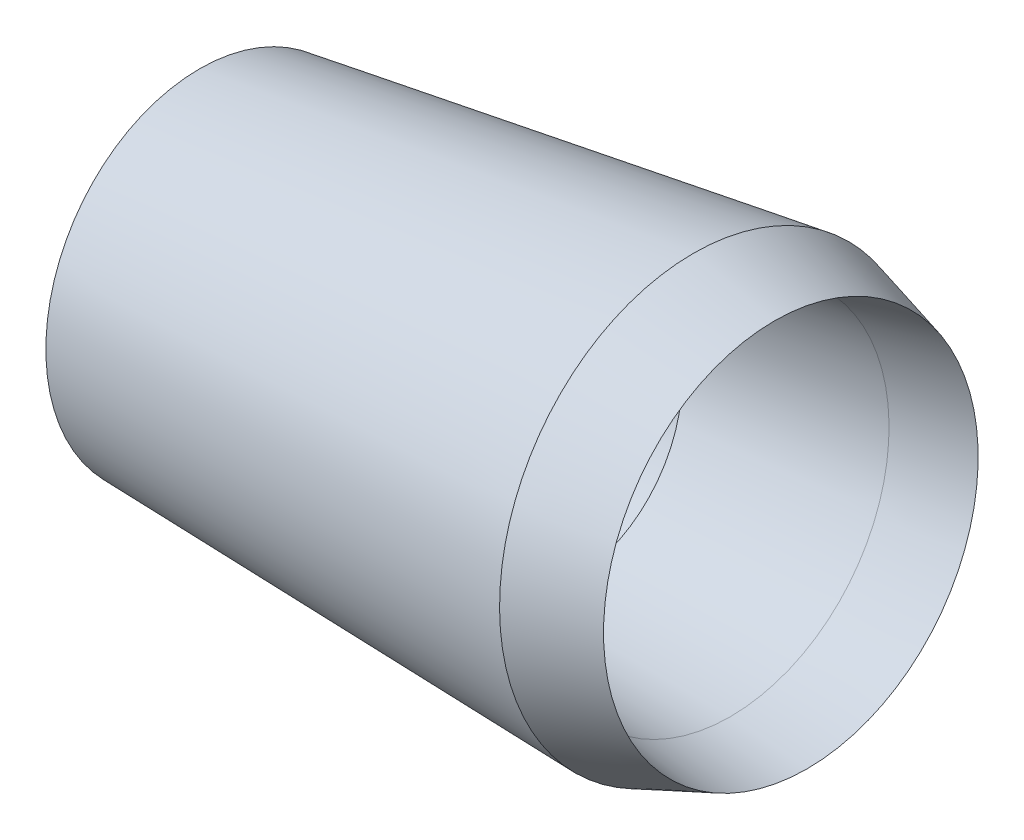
SolidWorks part; units mm, degrees
ref_plane "Front Plane" through (0, 0, 0) normal (0, 0, 1) x (1, 0, 0)
ref_plane "Top Plane" through (0, 0, 0) normal (0, 1, 0) x (1, 0, 0)
ref_plane "Right Plane" through (0, 0, 0) normal (1, 0, 0) x (0, 0, -1)
sketch "Sketch1" plane through (0, 0, 0) normal (0, 0, 1) x (1, 0, 0)
  line L0 (0, 0) -> (97.5367, 0) construction
  line L1 (0, 0) -> (6.35, -6.35)
  line L2 (6.35, -6.35) -> (50.8, -6.35)
  line L4 (292.1, 0) -> (259.4617, 0)
  line L5 (0, 0) -> (0, 25.5554) construction
  line L6 (203.2, -6.35) -> (292.1, -6.35)
  line L7 (145.1617, 12.7) -> (145.1617, 0) construction
  line L8 (0, 6.35) -> (292.1, 6.35) construction
  line L9 (145.1617, 0) -> (151.5117, 6.35)
  line L11 (151.5117, 6.35) -> (154.6867, 6.35)
  line L12 (148.3367, 0) -> (154.6867, 6.35)
  line L13 (-11.1934, -0.9793) -> (308.0638, 26.9521) construction
  line L14 (129.2867, 0) -> (135.6367, 6.35)
  line L16 (132.4617, 0) -> (138.8117, 6.35)
  line L17 (135.6367, 6.35) -> (138.8117, 6.35)
  line L18 (113.4117, 0) -> (119.7617, 6.35)
  line L20 (116.5867, 0) -> (122.9367, 6.35)
  line L21 (119.7617, 6.35) -> (122.9367, 6.35)
  line L22 (97.5367, 0) -> (103.8867, 6.35)
  line L24 (100.7117, 0) -> (107.0617, 6.35)
  line L25 (103.8867, 6.35) -> (107.0617, 6.35)
  line L26 (161.0367, 0) -> (167.3867, 6.35)
  line L28 (164.2117, 0) -> (170.5617, 6.35)
  line L29 (167.3867, 6.35) -> (170.5617, 6.35)
  line L30 (176.9117, 0) -> (183.2617, 6.35)
  line L32 (180.0867, 0) -> (186.4367, 6.35)
  line L33 (183.2617, 6.35) -> (186.4367, 6.35)
  line L34 (192.7867, 0) -> (199.1367, 6.35)
  line L36 (195.9617, 0) -> (202.3117, 6.35)
  line L37 (199.1367, 6.35) -> (202.3117, 6.35)
  line L38 (208.6617, 0) -> (215.0117, 6.35)
  line L40 (211.8367, 0) -> (218.1867, 6.35)
  line L41 (215.0117, 6.35) -> (218.1867, 6.35)
  line L42 (224.5367, 0) -> (230.8867, 6.35)
  line L44 (227.7117, 0) -> (234.0617, 6.35)
  line L45 (230.8867, 6.35) -> (234.0617, 6.35)
  line L46 (240.4117, 0) -> (246.7617, 6.35)
  line L48 (243.5867, 0) -> (249.9367, 6.35)
  line L49 (246.7617, 6.35) -> (249.9367, 6.35)
  line L50 (256.2867, 0) -> (262.6367, 6.35)
  line L52 (259.4617, 0) -> (265.8117, 6.35)
  line L53 (262.6367, 6.35) -> (265.8117, 6.35)
  line L54 (29.792, 5.7936) -> (85.7641, 10.6905) construction
  line L55 (100.7117, 0) -> (113.4117, 0) construction
  line L56 (97.5367, 0) -> (0, 0)
  line L58 (113.4117, 0) -> (100.7117, 0)
  line L59 (116.5867, 0) -> (129.2867, 0) construction
  line L60 (291.396, -1.1111) -> (312.3584, -1.1111) construction
  line L61 (129.2867, 0) -> (116.5867, 0)
  line L62 (132.4617, 0) -> (145.1617, 0) construction
  line L63 (145.1617, 0) -> (132.4617, 0)
  line L64 (148.3367, 0) -> (161.0367, 0) construction
  line L65 (164.2117, 0) -> (176.9117, 0) construction
  line L66 (161.0367, 0) -> (148.3367, 0)
  line L67 (176.9117, 0) -> (164.2117, 0)
  line L68 (180.0867, 0) -> (192.7867, 0) construction
  line L69 (192.7867, 0) -> (180.0867, 0)
  line L70 (195.9617, 0) -> (208.6617, 0) construction
  line L71 (208.6617, 0) -> (195.9617, 0)
  line L72 (211.8367, 0) -> (224.5367, 0) construction
  line L73 (224.5367, 0) -> (211.8367, 0)
  line L74 (227.7117, 0) -> (240.4117, 0) construction
  line L75 (240.4117, 0) -> (227.7117, 0)
  line L76 (243.5867, 0) -> (256.2867, 0) construction
  line L77 (256.2867, 0) -> (243.5867, 0)
  line L78 (259.4617, 0) -> (292.1, 0) construction
  line L79 (292.1, 0) -> (304.8, -1.1111)
  line L81 (292.1, 0) -> (292.1, 25.5554) construction
  line L82 (292.1, -6.35) -> (304.8, -1.1111)
  line L83 (292.1, 0) -> (292.1, -25.2445) construction
  arc A0 (57.15, -6.35) -> (50.8, -6.35) centre (53.975, -6.35) cw
  arc A1 (63.5, -6.35) -> (57.15, -6.35) centre (60.325, -6.35) cw
  arc A2 (69.85, -6.35) -> (63.5, -6.35) centre (66.675, -6.35) cw
  arc A3 (76.2, -6.35) -> (69.85, -6.35) centre (73.025, -6.35) cw
  arc A4 (82.55, -6.35) -> (76.2, -6.35) centre (79.375, -6.35) cw
  arc A5 (88.9, -6.35) -> (82.55, -6.35) centre (85.725, -6.35) cw
  arc A6 (95.25, -6.35) -> (88.9, -6.35) centre (92.075, -6.35) cw
  arc A7 (101.6, -6.35) -> (95.25, -6.35) centre (98.425, -6.35) cw
  arc A8 (107.95, -6.35) -> (101.6, -6.35) centre (104.775, -6.35) cw
  arc A9 (114.3, -6.35) -> (107.95, -6.35) centre (111.125, -6.35) cw
  arc A10 (120.65, -6.35) -> (114.3, -6.35) centre (117.475, -6.35) cw
  arc A11 (127, -6.35) -> (120.65, -6.35) centre (123.825, -6.35) cw
  arc A12 (133.35, -6.35) -> (127, -6.35) centre (130.175, -6.35) cw
  arc A13 (139.7, -6.35) -> (133.35, -6.35) centre (136.525, -6.35) cw
  arc A14 (146.05, -6.35) -> (139.7, -6.35) centre (142.875, -6.35) cw
  arc A15 (152.4, -6.35) -> (146.05, -6.35) centre (149.225, -6.35) cw
  arc A16 (158.75, -6.35) -> (152.4, -6.35) centre (155.575, -6.35) cw
  arc A17 (165.1, -6.35) -> (158.75, -6.35) centre (161.925, -6.35) cw
  arc A18 (171.45, -6.35) -> (165.1, -6.35) centre (168.275, -6.35) cw
  arc A19 (177.8, -6.35) -> (171.45, -6.35) centre (174.625, -6.35) cw
  arc A20 (184.15, -6.35) -> (177.8, -6.35) centre (180.975, -6.35) cw
  arc A21 (190.5, -6.35) -> (184.15, -6.35) centre (187.325, -6.35) cw
  arc A22 (196.85, -6.35) -> (190.5, -6.35) centre (193.675, -6.35) cw
  arc A23 (203.2, -6.35) -> (196.85, -6.35) centre (200.025, -6.35) cw
  point P29 (145.1617, 6.35)
  dimension "D12" = 3.175
  dimension "D1" = 292.1
  dimension "D2" = 45
  dimension "D3" = 6.35
  dimension "D4" = 4
  dimension "D5" = 3.175
  dimension "D6" = 3.175
  dimension "D7" = 5
  dimension "D8" = 12.7
  dimension "D10" = 12.7
  dimension "D11" = 50.8
  dimension "D14" = 6.35
  dimension "D15" = 45
  dimension "D16" = 175
  dimension "D17" = 12.7
  dimension "D9" = 8
  dimension "D13" = 24
revolve "Revolve2" add sketch "Sketch1" angle 360 about L54
ref_plane "Plane1" through (96.7958, 8.4685, 0) normal (0.9962, 0.0872, 0) x (0, 0, -1)
ref_plane "Plane2" through (207.0766, 18.1169, 0) normal (0.9962, 0.0872, 0) x (0, 0, -1)
other "SurfaceCut4"
other "SurfaceCut6"
